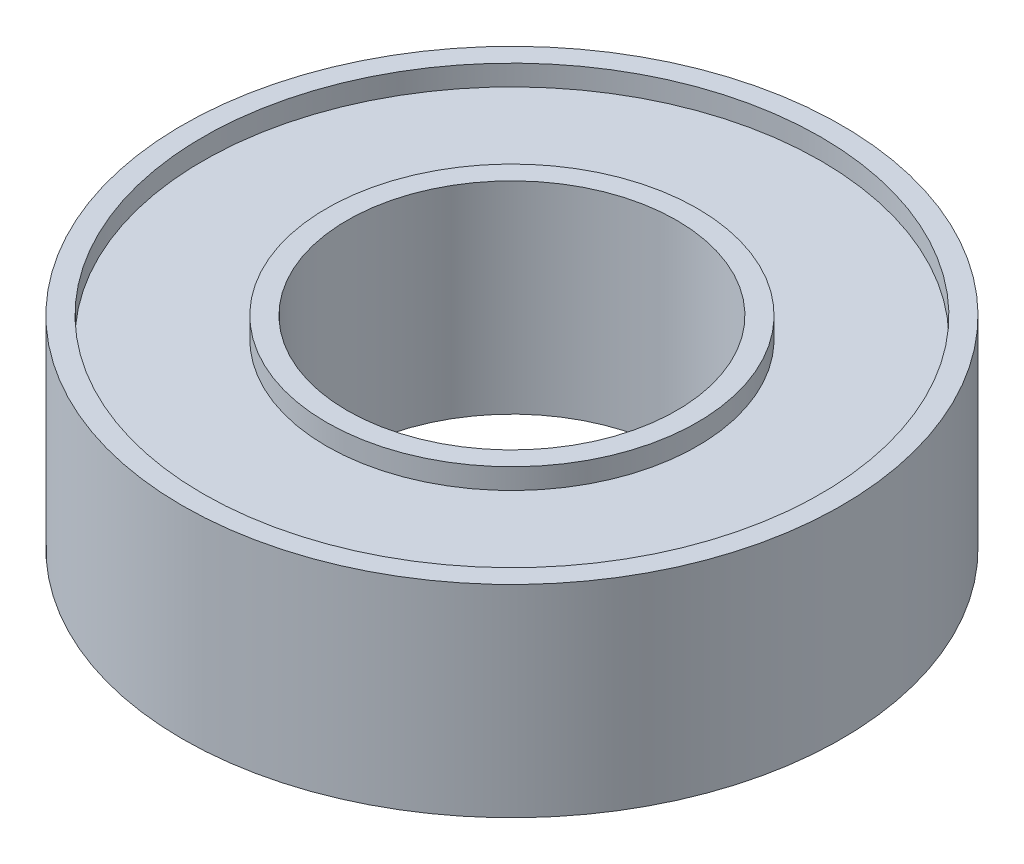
SolidWorks part; units mm, degrees
ref_plane "Front Plane" through (0, 0, 0) normal (0, 0, 1) x (1, 0, 0)
ref_plane "Top Plane" through (0, 0, 0) normal (0, 1, 0) x (1, 0, 0)
ref_plane "Right Plane" through (0, 0, 0) normal (1, 0, 0) x (0, 0, -1)
sketch "Sketch1" plane through (0, 0, 0) normal (0, 1, 0) x (1, 0, 0)
  circle A0 centre (-11.3368, 8.9912) radius 6.35
  circle A1 centre (-11.3368, 8.9912) radius 3.175
  dimension "D1" = 6.35
  dimension "D2" = 12.7
extrude "Extrude1" add sketch "Sketch1" along normal blind 3.8925
sketch "Sketch2" plane through (0, 3.8925, 0) normal (0, 1, 0) x (1, 0, 0)
  circle A0 centre (-11.3368, 8.9912) radius 3.5719
  circle A1 centre (-11.3368, 8.9912) radius 5.9531
  dimension "D1" = 11.9062
  dimension "D2" = 7.1437
extrude "Extrude2" cut sketch "Sketch2" against normal blind 0.3969
sketch "Sketch3" plane through (0, 0, 0) normal (0, -1, 0) x (1, 0, 0)
  circle A0 centre (-11.3368, -8.9912) radius 3.5719
  circle A1 centre (-11.3368, -8.9912) radius 5.9531
  dimension "D1" = 11.9062
  dimension "D2" = 7.1437
extrude "Extrude3" cut sketch "Sketch3" against normal blind 0.3969
